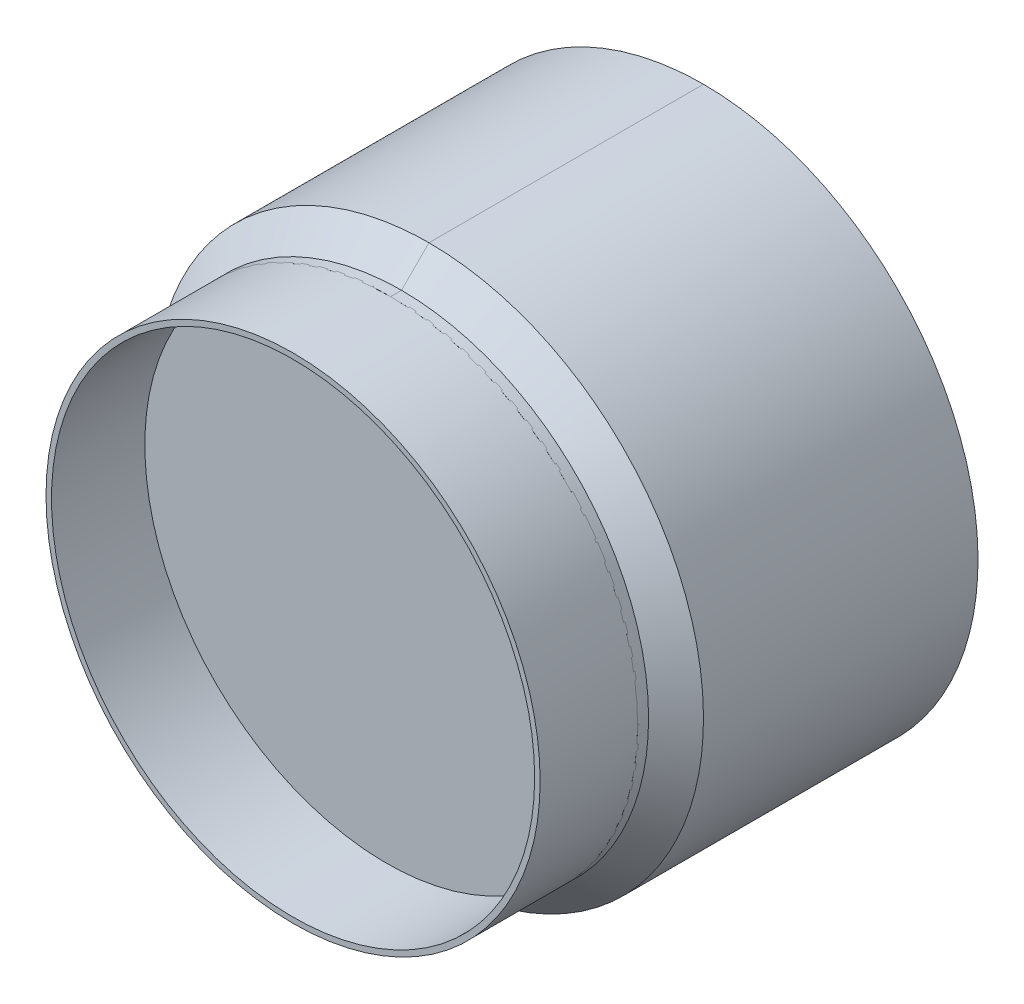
SolidWorks part; units mm, degrees
ref_plane "Alzado" through (0, 0, 0) normal (0, 0, 1) x (1, 0, 0)
ref_plane "Planta" through (0, 0, 0) normal (0, 1, 0) x (1, 0, 0)
ref_plane "Vista lateral" through (0, 0, 0) normal (1, 0, 0) x (0, 0, -1)
imported_body "Cade collection.stp-1/Cade collection89.stp-1-solid1"
imported_body "Cade collection.stp-1/Cade collection90.stp-1-solid1"
imported_body "Cade collection.stp-1/Cade collection98.stp-1-solid1"
imported_body "Cade collection.stp-1/Cade collection99.stp-1-solid1"
ref_plane "Plano1" through (0, 0, 345.5) normal (0, 0, 1) x (1, 0, 0)
sketch "Croquis1" plane through (0, 0, 345.5) normal (0, 0, 1) x (1, 0, 0)
  circle A0 centre (309, -168) radius 45
extrude "Saliente-Extruir1" add sketch "Croquis1" along normal blind 18 separate body
shell "Vaciado1" thickness 1
ref_plane "Plano2" through (0, -170, 0) normal (0, 1, 0) x (1, 0, 0)
